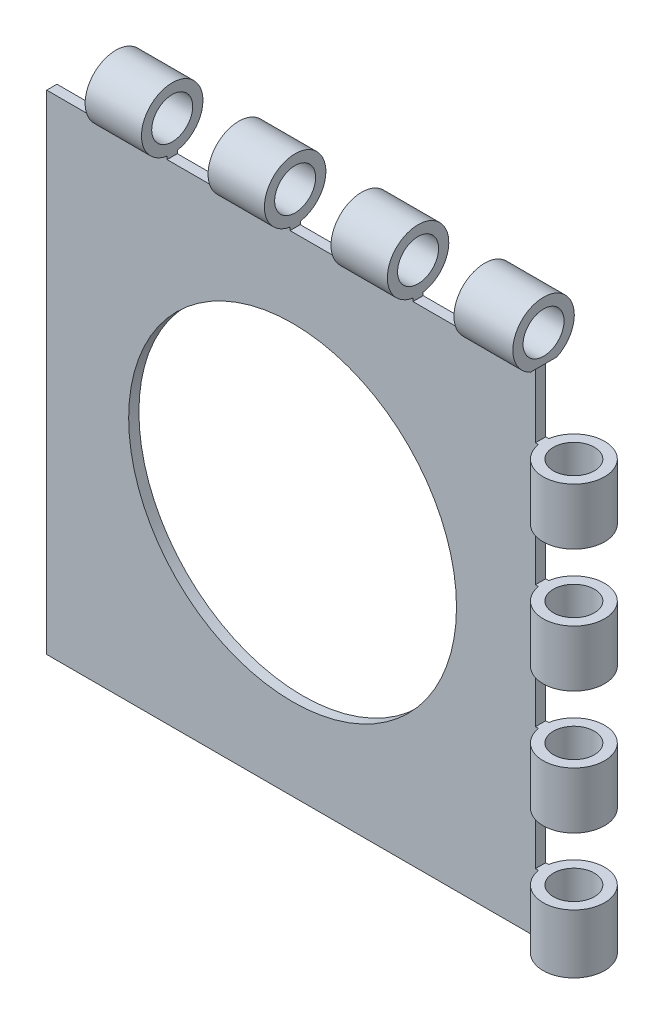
SolidWorks part; units mm, degrees
ref_plane "Front" through (0, 0, 0) normal (0, 0, 1) x (1, 0, 0)
ref_plane "Top" through (0, 0, 0) normal (0, 1, 0) x (1, 0, 0)
ref_plane "Right" through (0, 0, 0) normal (1, 0, 0) x (0, 0, -1)
sketch "Sketch1" plane through (0, 0, 0) normal (0, 0, 1) x (1, 0, 0)
  line L0 (0, 0) -> (76.2, 0)
  line L1 (0, 0) -> (0, 76.2)
  line L2 (76.2, 76.2) -> (0, 76.2)
  line L3 (76.2, 76.2) -> (76.2, 0)
  dimension "D1" = 76.2
  dimension "D2" = 76.2
extrude "Base-Extrude" add sketch "Sketch1" along normal blind 1.5875
sketch "Sketch2" plane through (0, 76.2, 0) normal (0, 1, 0) x (-1, 0, 0)
  line L0 (-76.2, 1.5875) -> (-80.8959, 0.7938) construction
  line L1 (-76.2, 0) -> (-80.8959, 0.7938) construction
  circle A0 centre (-80.8959, 0.7938) radius 4.7625
  dimension "D1" = 9.525
extrude "Boss-Extrude2" add sketch "Sketch2" against normal blind 76.2
sketch "Sketch3"
  circle A0 centre (-82.1292, 12.7605) radius 4.7625
  point P0 (-82.923, 8.0646)
  point P2 (-81.3355, 8.0646)
extrude "Boss-Extrude4" add sketch "Sketch4" against normal blind 76.2
sketch "Sketch4" plane through (82.4329, 0, -0.4879) normal (0, -1, 0) x (1, 0, 0)
  line L0 (-82.4329, 2.0754) -> (-87.1288, 1.2816) construction
  line L1 (-82.4329, 0.4879) -> (-87.1288, 1.2816) construction
  circle A0 centre (-87.1288, 1.2816) radius 4.7625
  dimension "D1" = 9.525
extrude "Boss-Extrude3" add sketch "Sketch3" against normal blind 76.2
sketch "Sketch5" plane through (0, 0, 0) normal (0, 0, -1) x (-1, 0, 0)
  line L0 (-76.2, 76.2) -> (0, 0) construction
  circle A0 centre (-38.1, 38.1) radius 25.4
  dimension "D1" = 50.8
extrude "Cut-Extrude1" cut sketch "Sketch5" against normal through all
ref_plane "Plane1" through (0, 80.8959, 0) normal (0, -1, 0) x (0, 0, 1)
sketch "Sketch6" plane through (0, 0, 1.5875) normal (0, 0, 1) x (1, 0, 0)
  line L0 (72.9566, 25.5374) -> (87.615, 25.5374)
  line L1 (72.9566, 25.5374) -> (72.9566, 50.6626)
  line L2 (87.615, 50.6626) -> (72.9566, 50.6626)
  line L3 (87.615, 50.6626) -> (87.615, 25.5374)
  line L4 (76.2, 38.1) -> (87.615, 38.1) construction
  line L5 (76.2, 76.2) -> (76.2, 0) construction
extrude "Cut-Extrude2" cut sketch "Sketch6" against normal through all and the other way through all
sketch "Sketch7" plane through (0, 0, 0) normal (0, -1, 0) x (1, 0, 0)
  circle A0 centre (80.8959, 0.7938) radius 3.175
  dimension "D1" = 6.35
extrude "Cut-Extrude3" cut sketch "Sketch7" against normal through all
sketch "Sketch8" plane through (0, 0, 0) normal (-1, 0, 0) x (0, 0, 1)
  circle A0 centre (0.7938, 80.8959) radius 3.175
  dimension "D1" = 6.35
extrude "Cut-Extrude4" cut sketch "Sketch8" against normal through all
sketch "Sketch9" plane through (0, 0, 0) normal (0, -1, 0) x (1, 0, 0)
  circle A0 centre (-4.6959, 0.7937) radius 3.175
  dimension "D1" = 6.35
extrude "Cut-Extrude5" cut sketch "Sketch9" against normal through all
sketch "Sketch10" plane through (0, 0, 1.5875) normal (0, 0, 1) x (1, 0, 0)
  line L0 (76.1334, 76.2) -> (85.6584, 76.2) construction
  line L1 (76.1334, 76.2) -> (76.1334, 66.675) construction
  line L2 (85.6584, 66.675) -> (76.1334, 66.675) construction
  line L3 (85.6584, 66.675) -> (85.6584, 76.2) construction
  line L4 (80.8959, 0) -> (80.8959, 76.2) construction
  line L5 (85.6584, 76.2) -> (76.2, 76.2) construction
  line L23 (75.7365, 76.5969) -> (86.0553, 76.5969)
  line L24 (75.7365, 76.5969) -> (75.7365, 66.2781)
  line L25 (86.0553, 66.2781) -> (75.7365, 66.2781)
  line L26 (86.0553, 66.2781) -> (86.0553, 76.5969)
  line L27 (75.7365, 66.2781) -> (86.0553, 76.5969) construction
  line L28 (75.7365, 76.5969) -> (86.0553, 66.2781) construction
  line L29 (80.8959, 71.4375) -> (80.8959, 76.2) construction
  dimension "D1" = 9.525
  dimension "D2" = 0.3969
extrude "Cut-Extrude9" cut sketch "Sketch10" against normal through all and the other way through all
pattern_linear "LPattern1" count 4 spacing 19.05 along (0, -1, 0) of "Cut-Extrude9"
pattern_circular "CirPattern2" count 2 every 270 about axis through (38.1, 38.1, 0) along (0, 0, 1) of "LPattern1", "Cut-Extrude9"
